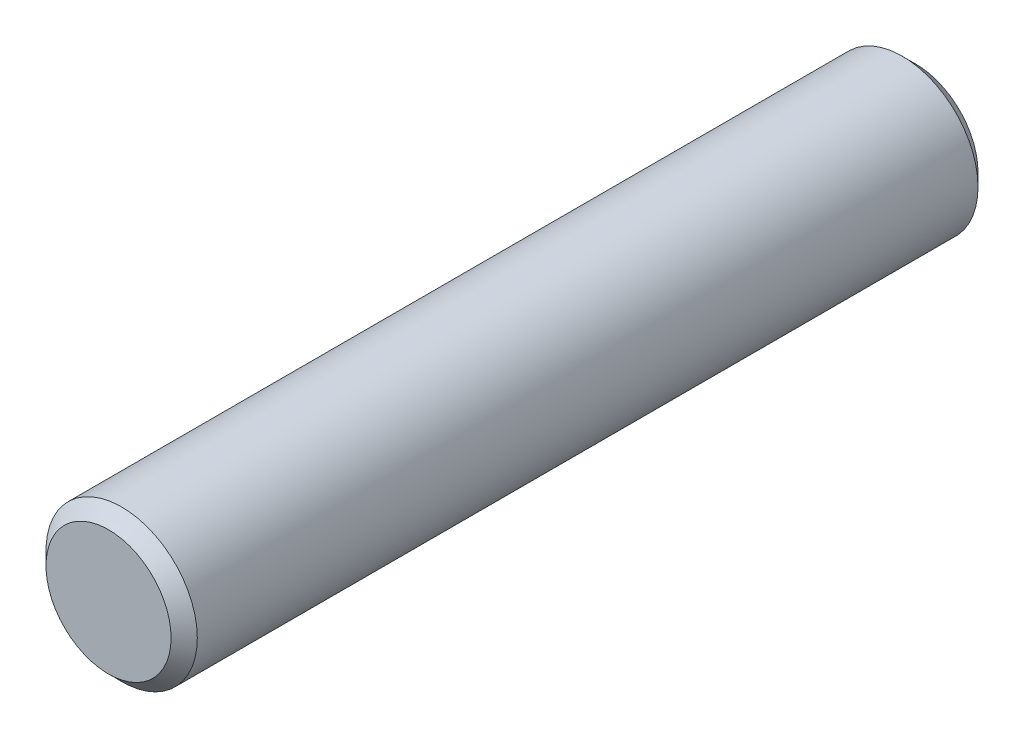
SolidWorks part; units mm, degrees
ref_plane "Front Plane" through (0, 0, 0) normal (0, 0, 1) x (1, 0, 0)
ref_plane "Top Plane" through (0, 0, 0) normal (0, 1, 0) x (1, 0, 0)
ref_plane "Right Plane" through (0, 0, 0) normal (1, 0, 0) x (0, 0, -1)
sketch "Sketch1" plane through (0, 0, 0) normal (0, 0, 1) x (1, 0, 0)
  circle A0 centre (0, 0) radius 4.7625
  dimension "D1" = 9.525
extrude "Extrude1" add sketch "Sketch1" along normal mid plane 50.8
chamfer "Chamfer1" distance 0.8255 angle 45 2 edges at (4.7625, 0, -25.4) (4.7625, 0, 25.4)
